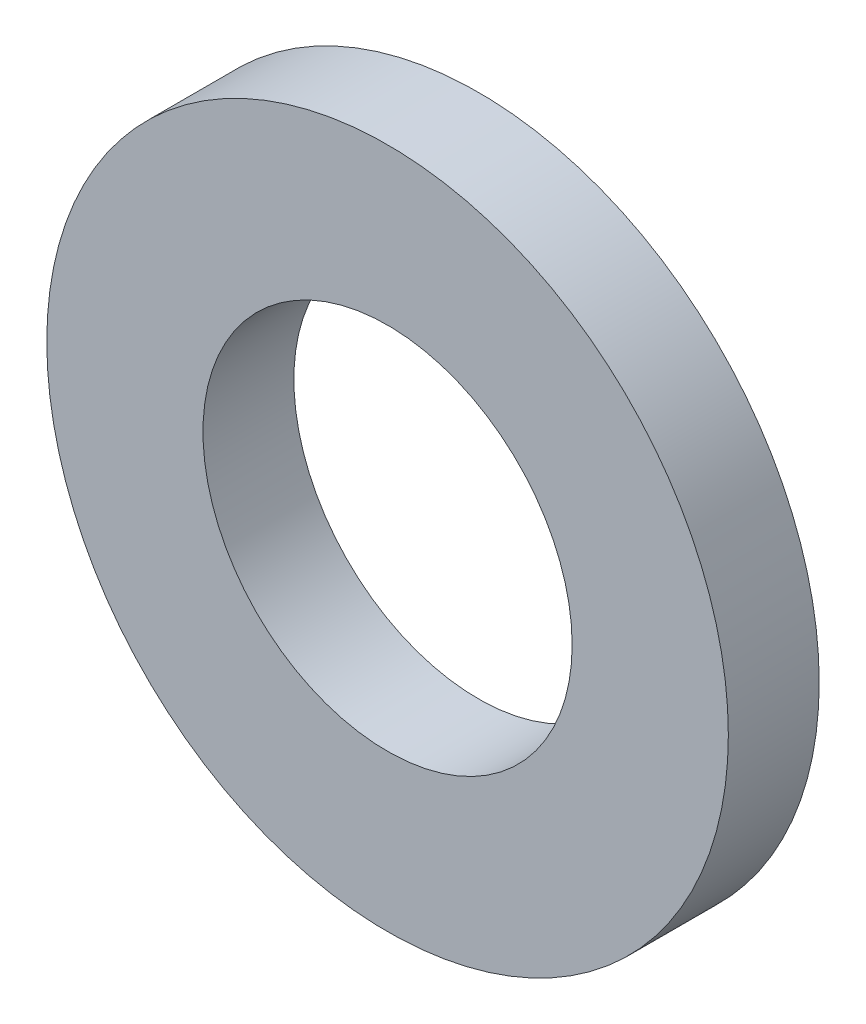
SolidWorks part; units mm, degrees
ref_plane "Plan de face" through (0, 0, 0) normal (0, 0, 1) x (1, 0, 0)
ref_plane "Plan de dessus" through (0, 0, 0) normal (0, 1, 0) x (1, 0, 0)
ref_plane "Plan de droite" through (0, 0, 0) normal (1, 0, 0) x (0, 0, -1)
sketch "Esquisse1" plane through (0, 0, 0) normal (0, 0, 1) x (1, 0, 0)
  circle A0 centre (0, 0) radius 6
  circle A1 centre (0, 0) radius 3.25
  dimension "D1" = 6.5
  dimension "D2" = 12
extrude "Extrusion1" add sketch "Esquisse1" along normal blind 1.6
